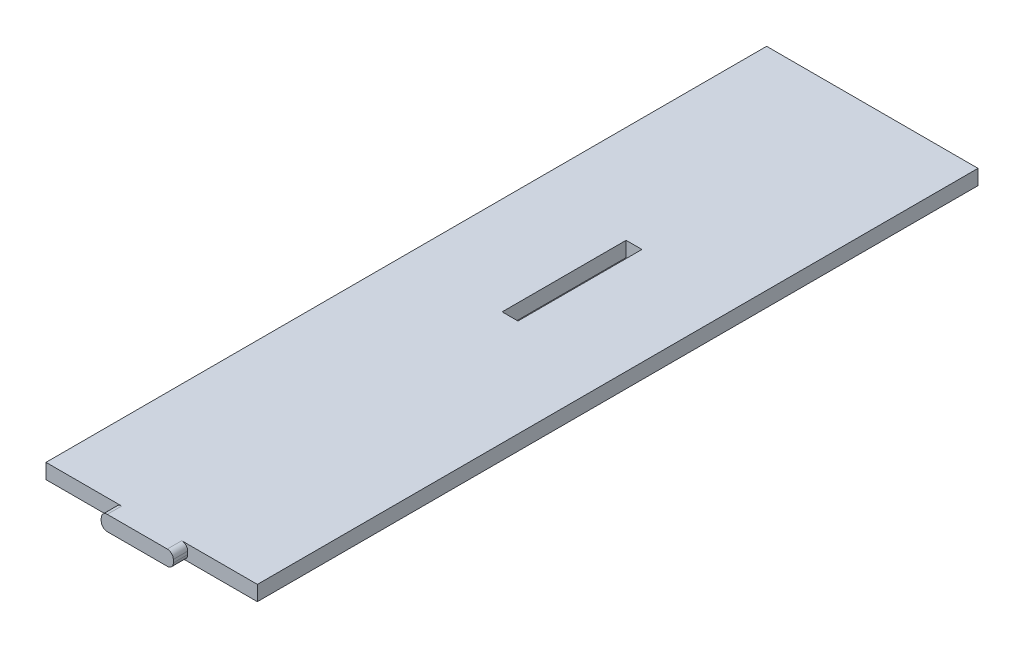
SolidWorks part; units mm, degrees
ref_plane "Front" through (0, 0, 0) normal (0, 0, 1) x (1, 0, 0)
ref_plane "Top" through (0, 0, 0) normal (0, 1, 0) x (1, 0, 0)
ref_plane "Right" through (0, 0, 0) normal (1, 0, 0) x (0, 0, -1)
sketch "Sketch1" plane through (0, 0, 0) normal (0, 1, 0) x (1, 0, 0)
  line L0 (-12.079, 250) -> (-12.079, -350) construction
  line L1 (-12.079, 58.4) -> (-12.079, -51.6) construction
  line L2 (-100.079, -350) -> (75.921, -350)
  line L8 (-5.479, 51.6) -> (-5.479, -51.6)
  line L11 (-18.679, 51.6) -> (-18.679, -51.6)
  line L14 (-100.079, 250) -> (75.921, 250)
  line L15 (-100.079, -350) -> (-100.079, 250)
  line L16 (75.921, -350) -> (75.921, 250)
  line L17 (-18.679, -51.6) -> (-5.479, -51.6)
  line L18 (-18.679, 51.6) -> (-5.479, 51.6)
  point P4 (-12.079, -50)
  point P7 (-12.079, -350)
  dimension "D2" = 600
  dimension "D1" = 176
  dimension "D3" = 110
extrude "Boss-Extrude1" add sketch "Sketch1" along normal blind 12.5
sketch "Sketch3" plane through (0, 0, 350) normal (0, 0, 1) x (1, 0, 0)
  line L0 (-100.079, 12.5) -> (75.921, 12.5) construction
  line L1 (-37.079, 12.5) -> (12.921, 12.5)
  line L2 (-42.079, 7.5) -> (-42.079, 5)
  line L3 (-37.079, 0) -> (12.921, 0)
  line L4 (17.921, 7.5) -> (17.921, 5)
  arc A0 (12.921, 0) -> (17.921, 5) centre (12.921, 5) ccw
  arc A1 (-42.079, 5) -> (-37.079, 0) centre (-37.079, 5) ccw
  arc A2 (-37.079, 12.5) -> (-42.079, 7.5) centre (-37.079, 7.5) ccw
  arc A3 (12.921, 12.5) -> (17.921, 7.5) centre (12.921, 7.5) cw
  point P4 (-12.079, 12.5)
  point P7 (-12.079, 12.5)
  point P12 (-42.079, 0)
  point P15 (-42.079, 12.5)
  point P18 (17.921, 12.5)
  dimension "D3" = 5
  dimension "D1" = 12.5
  dimension "D2" = 60
extrude "Boss-Extrude2" add sketch "Sketch3" along normal blind 12
